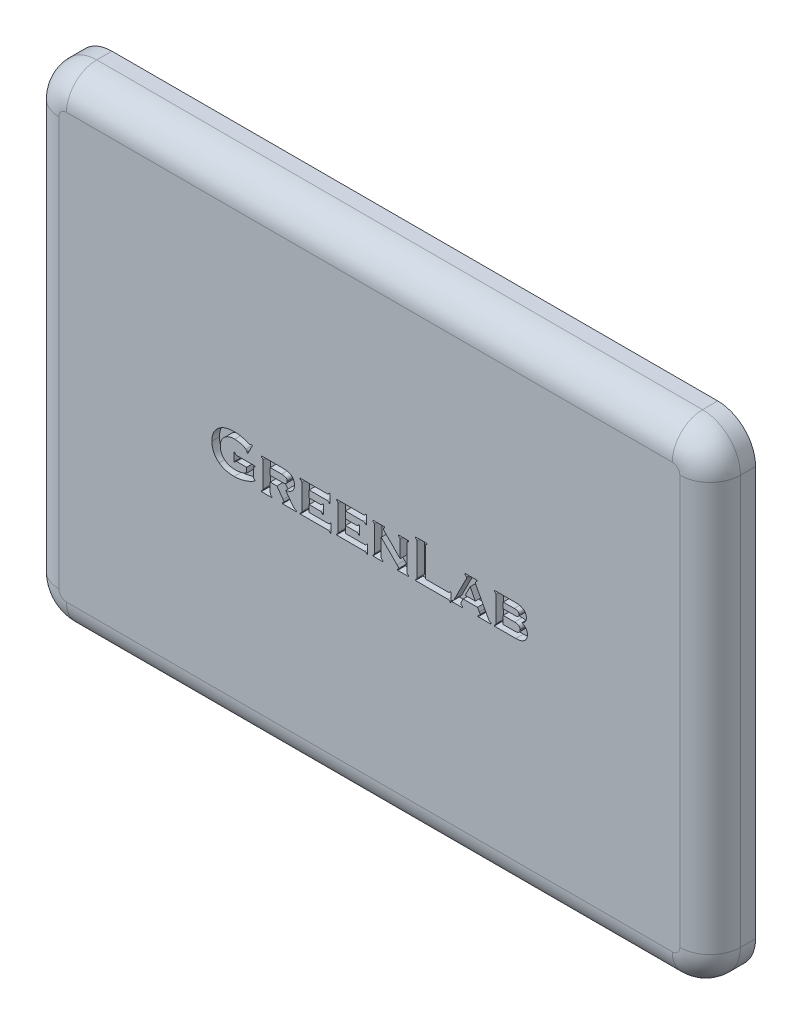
SolidWorks part; units mm, degrees
ref_plane "Front Plane" through (0, 0, 0) normal (0, 0, 1) x (1, 0, 0)
ref_plane "Top Plane" through (0, 0, 0) normal (0, 1, 0) x (1, 0, 0)
ref_plane "Right Plane" through (0, 0, 0) normal (1, 0, 0) x (0, 0, -1)
ref_plane "Plane1" through (0, 0, 3) normal (0, 0, 1) x (1, 0, 0)
sketch "Sketch1" plane through (0, 0, 3) normal (0, 0, 1) x (1, 0, 0)
  line L0 (22.5, -22.5) -> (22.5, 9.5)
  line L1 (22.5, 9.5) -> (-22.5, 9.5)
  line L2 (-22.5, 9.5) -> (-22.5, -22.5)
  line L3 (-22.5, -22.5) -> (22.5, -22.5)
  dimension "D1" = 45
  dimension "D2" = 32
extrude "Boss-Extrude1" add sketch "Sketch1" against normal blind 3
fillet "Fillet1" radius 2.5 4 edges at (-22.5, 9.5, 1.5) (22.5, 9.5, 1.5) (-22.5, -22.5, 1.5) (22.5, -22.5, 1.5)
fillet "Fillet2" radius 2 8 edges at (-21.7678, -21.7678, 3) (-22.5, -6.5, 3) (0, -22.5, 3) (-21.7678, 8.7678, 3) (21.7678, -21.7678, 3) (0, 9.5, 3) (22.5, -6.5, 3) (21.7678, 8.7678, 3)
sketch "Sketch2" plane through (0, 0, 3) normal (0, 0, 1) x (1, 0, 0)
  line L0 (-20.5, -7.75) -> (20.5, -7.75) construction
  line L1 (-20.5, 7) -> (-20.5, -20) construction
  line L2 (20.5, -20) -> (20.5, 7) construction
  line L3 (20, -22.5) -> (-20, -22.5) construction
  text T0 "GreenLab" font "Copperplate Gothic Bold" height 2.5
  dimension "D1" = 14.75
extrude "Cut-Extrude1" cut sketch "Sketch2" against normal blind 0.5
